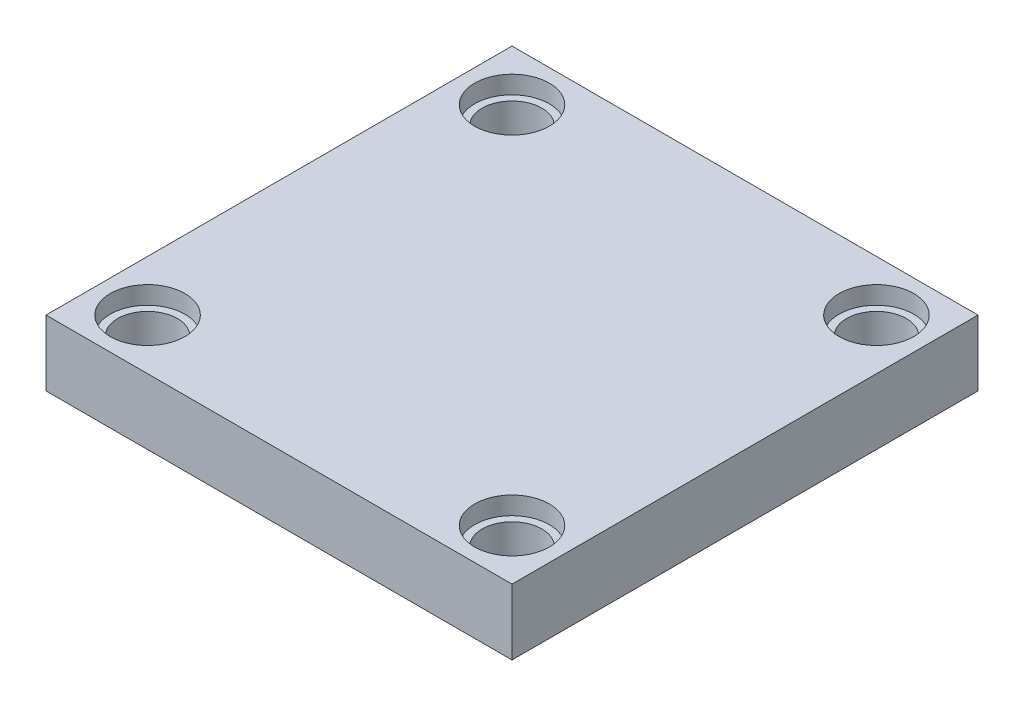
SolidWorks part; units mm, degrees
ref_plane "Plano frontal" through (0, 0, 0) normal (0, 0, 1) x (1, 0, 0)
ref_plane "Plano superior" through (0, 0, 0) normal (0, 1, 0) x (1, 0, 0)
ref_plane "Plano direito" through (0, 0, 0) normal (1, 0, 0) x (0, 0, -1)
sketch "Esboço1" plane through (0, 0, 0) normal (0, 1, 0) x (1, 0, 0)
  line L1 (-78, -78) -> (78, -78)
  line L2 (-78, -78) -> (-78, 78)
  line L3 (-78, 78) -> (78, 78)
  line L4 (78, -78) -> (78, 78)
  line L5 (-78, -78) -> (78, 78) construction
  line L6 (-78, 78) -> (78, -78) construction
  point P0 (0, 0)
  dimension "D1" = 156
  dimension "D2" = 156
extrude "Extrusão1" add sketch "Esboço1" along normal blind 22
sketch "Esboço2" plane through (0, 0, 0) normal (0, -1, 0) x (1, 0, 0)
  line L0 (78, 78) -> (78, -78) construction
  line L1 (-78, 78) -> (78, 78) construction
  circle A0 centre (61, 61) radius 10
  circle A1 centre (-61, 61) radius 10
  circle A2 centre (61, -61) radius 10
  circle A3 centre (-61, -61) radius 10
  dimension "D2" = 17
  dimension "D3" = 20
  dimension "D1" = 17
extrude "Extrusão2" cut sketch "Esboço2" against normal through all
sketch "Esboço3" plane through (0, 22, 0) normal (0, 1, 0) x (1, 0, 0)
  circle A0 centre (-61, 61) radius 12.5
  circle A1 centre (61, 61) radius 12.5
  circle A2 centre (-61, -61) radius 12.5
  circle A3 centre (61, -61) radius 12.5
  dimension "D1" = 25
extrude "Extrusão3" cut sketch "Esboço3" against normal blind 6
